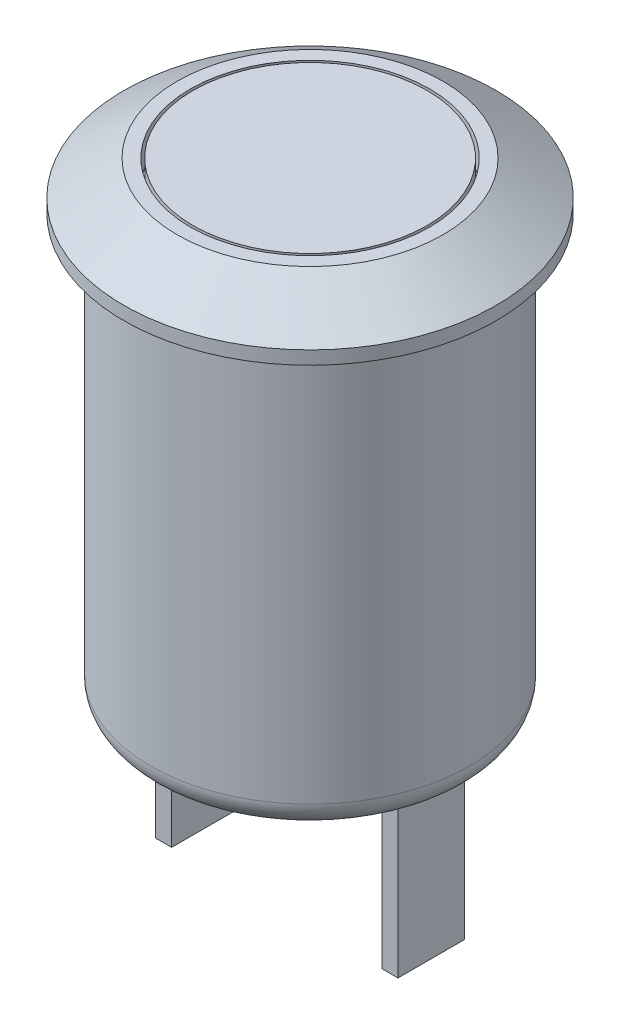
SolidWorks part; units mm, degrees
ref_plane "Plan de face" through (0, 0, 0) normal (0, 0, 1) x (1, 0, 0)
ref_plane "Plan de dessus" through (0, 0, 0) normal (0, 1, 0) x (1, 0, 0)
ref_plane "Plan de droite" through (0, 0, 0) normal (1, 0, 0) x (0, 0, -1)
sketch "Esquisse1" plane through (0, 0, 0) normal (0, 0, 1) x (1, 0, 0)
  line L0 (0, 0) -> (0, 10.0357) construction
  line L1 (0, 0) -> (0, 1.8)
  line L2 (0, 1.8) -> (4.4, 1.8)
  line L3 (4.4, 1.8) -> (4.4, 0.8)
  line L4 (4.4, 0.8) -> (4.5, 0.8)
  line L5 (4.5, 0.8) -> (4.5, 1.8)
  line L6 (4.5, 1.8) -> (5, 1.8)
  line L7 (5, 1.8) -> (7, 0.5)
  line L8 (7, 0.5) -> (7, 0)
  line L9 (7, 0) -> (6, 0)
  line L10 (6, 0) -> (6, -16)
  line L11 (6, -16) -> (0, -16)
  line L12 (0, -16) -> (0, 0)
  point P4 (5.2998, 1.3643)
  point P15 (7, 0.1629)
  point P16 (7.4531, -0.8)
  point P17 (0.3372, -0.4916)
  point P18 (0, 0)
  dimension "D1" = 12
  dimension "D2" = 9
  dimension "D3" = 14
  dimension "D4" = 1.8
  dimension "D5" = 2
  dimension "D6" = 1.3
  dimension "D7" = 1
  dimension "D8" = 0.1
  dimension "D9" = 16
revolve "Révolution1" add sketch "Esquisse1" angle 360 about L0
fillet "Congé1" radius 1 1 edges at (0, -16, -6)
sketch "Esquisse2" plane through (0, -16, 0) normal (0, -1, 0) x (1, 0, 0)
  line L0 (-4.5543, 1.25) -> (-4.5543, -1.25)
  line L1 (-4.5543, 1.25) -> (-3.9543, 1.25)
  line L2 (-4.5543, -1.25) -> (-3.9543, -1.25)
  line L3 (-3.9543, 1.25) -> (-3.9543, -1.25)
  line L4 (3.9543, 1.25) -> (3.9543, -1.25)
  line L5 (3.9543, 1.25) -> (4.5543, 1.25)
  line L6 (3.9543, -1.25) -> (4.5543, -1.25)
  line L7 (4.5543, 1.25) -> (4.5543, -1.25)
  line L8 (-4.5543, 1.25) -> (4.5543, -1.25) construction
  point P0 (-2.801, 1.0682)
  dimension "D1" = 0.6
  dimension "D2" = 2.5
extrude "Boss.-Extru.1" add sketch "Esquisse2" along normal blind 6
